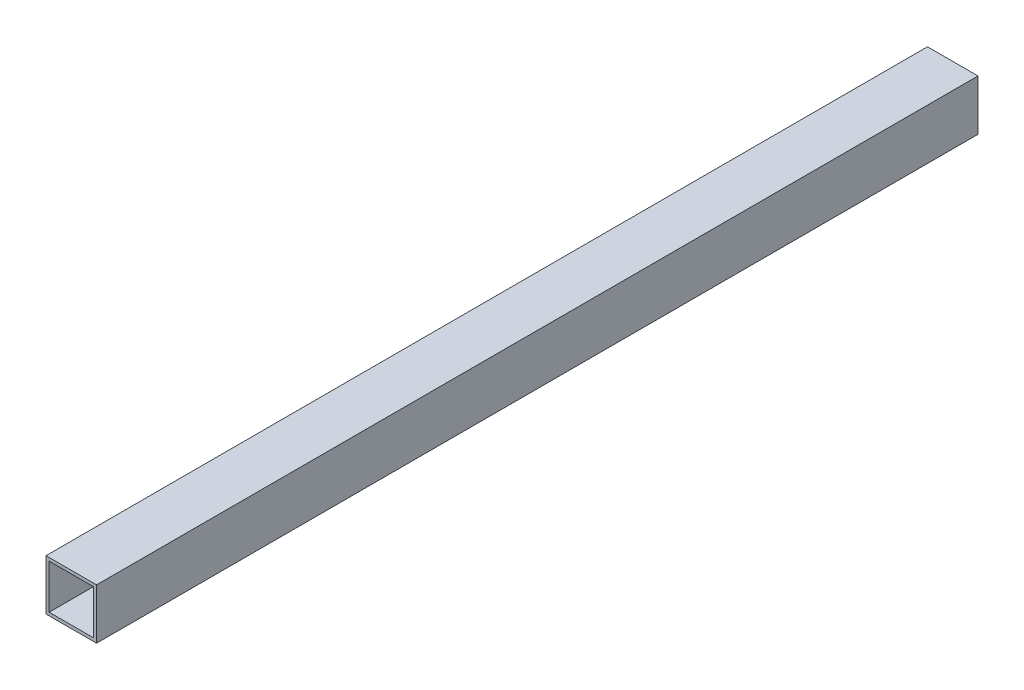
SolidWorks part; units mm, degrees
ref_plane "Front Plane" through (0, 0, 0) normal (0, 0, 1) x (1, 0, 0)
ref_plane "Top Plane" through (0, 0, 0) normal (0, 1, 0) x (1, 0, 0)
ref_plane "Right Plane" through (0, 0, 0) normal (1, 0, 0) x (0, 0, -1)
ref_plane "Plane1" through (0, 0, 863.6) normal (0, 0, 1) x (1, 0, 0)
sketch "Sketch1" plane through (0, 0, 863.6) normal (0, 0, 1) x (1, 0, 0)
  line L0 (25.4, -25.4) -> (25.4, 25.4)
  line L1 (25.4, 25.4) -> (-25.4, 25.4)
  line L2 (-25.4, 25.4) -> (-25.4, -25.4)
  line L3 (-25.4, -25.4) -> (25.4, -25.4)
  line L4 (22.225, 22.225) -> (22.225, -22.225)
  line L5 (22.225, -22.225) -> (-22.225, -22.225)
  line L6 (-22.225, -22.225) -> (-22.225, 22.225)
  line L7 (-22.225, 22.225) -> (22.225, 22.225)
extrude "Boss-Extrude1" add sketch "Sketch1" against normal up to surface (885.825 mm away)
